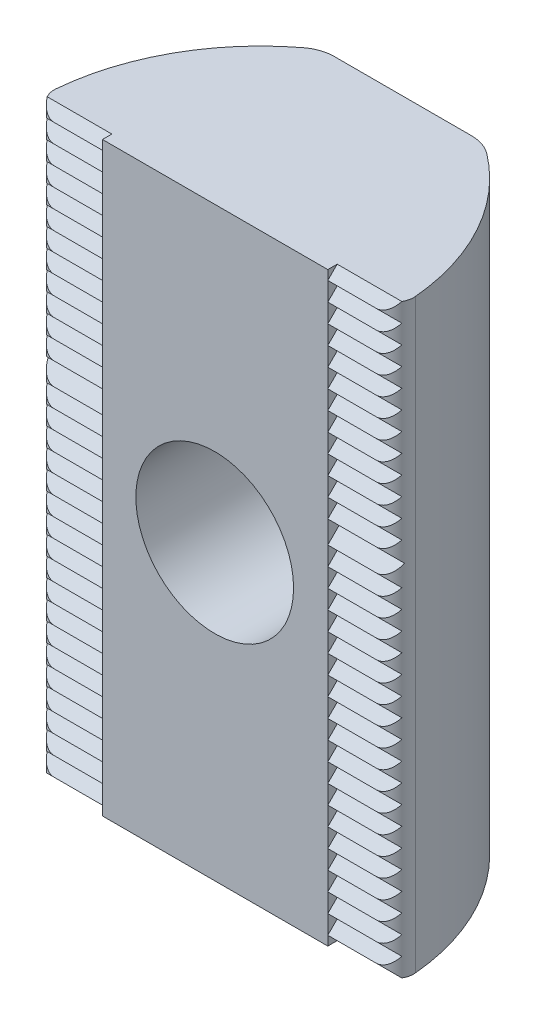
SolidWorks part; units mm, degrees
ref_plane "正面" through (0, 0, 0) normal (0, 0, 1) x (1, 0, 0)
ref_plane "平面" through (0, 0, 0) normal (0, 1, 0) x (1, 0, 0)
ref_plane "右側面" through (0, 0, 0) normal (1, 0, 0) x (0, 0, -1)
sketch "ｽｹｯﾁ1" plane through (0, 0, 0) normal (0, -1, 0) x (1, 0, 0)
  line L8 (-4.2884, 0) -> (4.2884, 0)
  line L9 (1.8306, -5) -> (-1.8306, -5)
  arc A8 (-4.7865, -0.544) -> (-2.4348, -4.7969) centre (1.1902, -0.0157) ccw
  arc A9 (-2.4348, -4.7969) -> (-1.8306, -5) centre (-1.8306, -4) ccw
  arc A10 (-4.2884, 0) -> (-4.7865, -0.544) centre (-4.2884, -0.5) ccw
  arc A11 (2.4348, -4.7969) -> (4.7865, -0.544) centre (-1.1902, -0.0157) ccw
  arc A12 (1.8306, -5) -> (2.4348, -4.7969) centre (1.8306, -4) ccw
  arc A13 (4.7865, -0.544) -> (4.2884, 0) centre (4.2884, -0.5) ccw
extrude "押し出し1" add sketch "ｽｹｯﾁ1" along normal mid plane 15.6
hole_wizard "M5x0.8 ねじ穴1" positions "ｽｹｯﾁ3" profile "ｽｹｯﾁ2" tap size "M5x0.8" standard "JIS"
sketch "ｽｹｯﾁ3" plane through (1.3374, 5.2145, 0) normal (0, 0, 1) x (1, 0, 0)
  line L1 (2.951, -13.0145) -> (-5.6258, -13.0145) construction
  line L3 (2.951, -13.0145) -> (2.951, 2.5855) construction
  point P0 (-1.349, -5.2145)
  dimension "D1" = 7.8
  dimension "D2" = 4.3
sketch "ｽｹｯﾁ2" plane through (-0.0116, 0, 0) normal (1, 0, 0) x (0, -1, 0)
  line L0 (0, 0) -> (0, 5)
  line L1 (0, 5) -> (2.1, 5)
  line L2 (2.1, 5) -> (2.1, 0)
  line L5 (2.1, 0) -> (0, 0)
  line L11 (0, -6.35) -> (0, 107.95) construction
  dimension "次ｻｰﾌｪｽまでのねじ下穴ﾄﾞﾘﾙの直径" = 4.2
  dimension "次ｻｰﾌｪｽまでのねじ下穴ﾄﾞﾘﾙの深さ" = 5
ref_plane "平面1" through (3, 0, 0) normal (1, 0, 0) x (0, 0, -1)
ref_plane "平面2" through (-3, 0, 0) normal (1, 0, 0) x (0, 0, -1)
sketch "ｽｹｯﾁ4" plane through (3, 0, 0) normal (1, 0, 0) x (0, 0, -1)
  line L0 (0.25, -7.8) -> (-2.0124, -7.8)
  line L1 (-2.0124, -7.8) -> (-2.0124, 7.8)
  line L2 (-2.0124, 7.8) -> (0.25, 7.8)
  line L3 (0, -7.05) -> (0.25, -6.8)
  line L6 (0.25, -7.3) -> (0, -7.05)
  line L7 (0.25, -7.8) -> (0, -7.55)
  line L8 (0, -7.55) -> (0.25, -7.3)
  line L9 (0, 4.55) -> (0.25, 4.8)
  line L10 (0.25, -1.3) -> (0, -1.05)
  line L13 (0.25, -4.3) -> (0, -4.05)
  line L14 (0, -6.55) -> (0.25, -6.3)
  line L15 (0.25, -6.8) -> (0, -6.55)
  line L16 (0, -4.55) -> (0.25, -4.3)
  line L17 (0.25, -5.3) -> (0, -5.05)
  line L18 (0, -6.05) -> (0.25, -5.8)
  line L19 (0.25, -6.3) -> (0, -6.05)
  line L20 (0.25, -5.8) -> (0, -5.55)
  line L21 (0, -5.55) -> (0.25, -5.3)
  line L22 (0, -5.05) -> (0.25, -4.8)
  line L23 (0.25, -4.8) -> (0, -4.55)
  line L24 (0, -2.55) -> (0.25, -2.3)
  line L25 (0.25, -3.3) -> (0, -3.05)
  line L26 (0, -4.05) -> (0.25, -3.8)
  line L27 (0.25, -3.8) -> (0, -3.55)
  line L28 (0, -3.55) -> (0.25, -3.3)
  line L29 (0, -3.05) -> (0.25, -2.8)
  line L30 (0.25, -2.8) -> (0, -2.55)
  line L31 (0, -2.05) -> (0.25, -1.8)
  line L32 (0.25, -2.3) -> (0, -2.05)
  line L33 (0.25, -1.8) -> (0, -1.55)
  line L34 (0, -1.55) -> (0.25, -1.3)
  line L37 (0, -0.55) -> (0.25, -0.3)
  line L38 (0, -1.05) -> (0.25, -0.8)
  line L39 (0.25, -0.8) -> (0, -0.55)
  line L40 (0, 1.45) -> (0.3, 1.75)
  line L41 (0.25, 0.7) -> (0, 0.95)
  line L42 (0, -0.05) -> (0.25, 0.2)
  line L43 (0.25, -0.3) -> (0, -0.05)
  line L44 (0.25, 0.2) -> (0, 0.45)
  line L45 (0, 0.45) -> (0.25, 0.7)
  line L46 (0, 0.95) -> (0.25, 1.2)
  line L47 (0.25, 1.2) -> (0, 1.45)
  line L48 (0, 3.55) -> (0.25, 3.8)
  line L49 (0.25, 2.8) -> (0, 3.05)
  line L50 (0, 2.05) -> (0.25, 2.3)
  line L51 (0.3, 1.75) -> (0, 2.05)
  line L52 (0.25, 2.3) -> (0, 2.55)
  line L53 (0, 2.55) -> (0.25, 2.8)
  line L54 (0, 3.05) -> (0.25, 3.3)
  line L55 (0.25, 3.3) -> (0, 3.55)
  line L56 (0, 4.05) -> (0.25, 4.3)
  line L57 (0.25, 3.8) -> (0, 4.05)
  line L58 (0.25, 4.3) -> (0, 4.55)
  line L60 (0.25, 7.3) -> (0, 7.55)
  line L61 (0, 5.55) -> (0.25, 5.8)
  line L62 (0.25, 4.8) -> (0, 5.05)
  line L63 (0, 5.05) -> (0.25, 5.3)
  line L64 (0.25, 5.3) -> (0, 5.55)
  line L65 (0, 7.05) -> (0.25, 7.3)
  line L66 (0.25, 6.8) -> (0, 7.05)
  line L67 (0.25, 6.3) -> (0, 6.55)
  line L68 (0, 6.55) -> (0.25, 6.8)
  line L69 (0.25, 5.8) -> (0, 6.05)
  line L70 (0, 6.05) -> (0.25, 6.3)
  line L71 (0, 7.55) -> (0.25, 7.8)
extrude "押し出し2" cut sketch "ｽｹｯﾁ4" along normal through all contours L60 L71 L2 L1 L0 L7 L8 L6 L3 L15 L14 L19 L18 L20 L21 L17 L22 L23 L16 L13 L26 L27 L28 L25 L29 L30 L24 L32 L31 L33 L34 L10 L38 L39 L37 L43 L42 L44 L45 L41 L46 L47 L40 L51 L50 L52 L53 L49 L54 L55 L48
sketch "ｽｹｯﾁ5" plane through (-3, 0, 0) normal (1, 0, 0) x (0, 0, -1)
  line L1 (-2.0124, 7.8) -> (0.25, 7.8) construction
  line L2 (-2.0124, -7.8) -> (-2.0124, 7.8) construction
  line L3 (0.25, -7.8) -> (-2.0124, -7.8) construction
  line L4 (0.25, -7.8) -> (0, -7.55) construction
  line L5 (0, -7.55) -> (0.25, -7.3) construction
  line L6 (0.25, -7.3) -> (0, -7.05) construction
  line L7 (0, -7.05) -> (0.25, -6.8) construction
  line L8 (0.25, -6.8) -> (0, -6.55) construction
  line L9 (0, -6.55) -> (0.25, -6.3) construction
  line L10 (0.25, -6.3) -> (0, -6.05) construction
  line L11 (0, -6.05) -> (0.25, -5.8) construction
  line L12 (0.25, -5.8) -> (0, -5.55) construction
  line L13 (0, -5.55) -> (0.25, -5.3) construction
  line L14 (0.25, -5.3) -> (0, -5.05) construction
  line L15 (0, -5.05) -> (0.25, -4.8) construction
  line L16 (0.25, -4.8) -> (0, -4.55) construction
  line L17 (0, -4.55) -> (0.25, -4.3) construction
  line L18 (0.25, -4.3) -> (0, -4.05) construction
  line L19 (0, -4.05) -> (0.25, -3.8) construction
  line L20 (0.25, -3.8) -> (0, -3.55) construction
  line L21 (0, -3.55) -> (0.25, -3.3) construction
  line L22 (0.25, -3.3) -> (0, -3.05) construction
  line L23 (0, -3.05) -> (0.25, -2.8) construction
  line L24 (0.25, -2.8) -> (0, -2.55) construction
  line L25 (0, -2.55) -> (0.25, -2.3) construction
  line L26 (0.25, -2.3) -> (0, -2.05) construction
  line L27 (0, -2.05) -> (0.25, -1.8) construction
  line L28 (0.25, -1.8) -> (0, -1.55) construction
  line L29 (0, -1.55) -> (0.25, -1.3) construction
  line L30 (0.25, -1.3) -> (0, -1.05) construction
  line L31 (0, -1.05) -> (0.25, -0.8) construction
  line L32 (0.25, -0.8) -> (0, -0.55) construction
  line L33 (0, -0.55) -> (0.25, -0.3) construction
  line L34 (0.25, -0.3) -> (0, -0.05) construction
  line L35 (0, -0.05) -> (0.25, 0.2) construction
  line L36 (0.25, 0.2) -> (0, 0.45) construction
  line L37 (0, 0.45) -> (0.25, 0.7) construction
  line L38 (0.25, 0.7) -> (0, 0.95) construction
  line L39 (0, 0.95) -> (0.25, 1.2) construction
  line L40 (0.25, 1.2) -> (0, 1.45) construction
  line L41 (0, 1.45) -> (0.3, 1.75) construction
  line L42 (0.3, 1.75) -> (0, 2.05) construction
  line L43 (0, 2.05) -> (0.25, 2.3) construction
  line L44 (0.25, 2.3) -> (0, 2.55) construction
  line L45 (0, 2.55) -> (0.25, 2.8) construction
  line L46 (0.25, 2.8) -> (0, 3.05) construction
  line L47 (0, 3.05) -> (0.25, 3.3) construction
  line L48 (0.25, 3.3) -> (0, 3.55) construction
  line L49 (0, 3.55) -> (0.25, 3.8) construction
  line L50 (0.25, 3.8) -> (0, 4.05) construction
  line L51 (0, 4.05) -> (0.25, 4.3) construction
  line L52 (0.25, 4.3) -> (0, 4.55) construction
  line L53 (0, 4.55) -> (0.25, 4.8) construction
  line L54 (0.25, 4.8) -> (0, 5.05) construction
  line L55 (0, 5.05) -> (0.25, 5.3) construction
  line L56 (0.25, 5.3) -> (0, 5.55) construction
  line L57 (0, 5.55) -> (0.25, 5.8) construction
  line L58 (0.25, 5.8) -> (0, 6.05) construction
  line L59 (0, 6.05) -> (0.25, 6.3) construction
  line L60 (0.25, 6.3) -> (0, 6.55) construction
  line L61 (0, 6.55) -> (0.25, 6.8) construction
  line L62 (0.25, 6.8) -> (0, 7.05) construction
  line L63 (0, 7.05) -> (0.25, 7.3) construction
  line L64 (0.25, 7.3) -> (0, 7.55) construction
  line L65 (0, 7.55) -> (0.25, 7.8) construction
  line L67 (-2.0124, 7.8) -> (0.25, 7.8)
  line L68 (-2.0124, -7.8) -> (-2.0124, 7.8)
  line L69 (0.25, -7.8) -> (-2.0124, -7.8)
  line L70 (0.25, -7.8) -> (0, -7.55)
  line L71 (0, -7.55) -> (0.25, -7.3)
  line L72 (0.25, -7.3) -> (0, -7.05)
  line L73 (0, -7.05) -> (0.25, -6.8)
  line L74 (0.25, -6.8) -> (0, -6.55)
  line L75 (0, -6.55) -> (0.25, -6.3)
  line L76 (0.25, -6.3) -> (0, -6.05)
  line L77 (0, -6.05) -> (0.25, -5.8)
  line L78 (0.25, -5.8) -> (0, -5.55)
  line L79 (0, -5.55) -> (0.25, -5.3)
  line L80 (0.25, -5.3) -> (0, -5.05)
  line L81 (0, -5.05) -> (0.25, -4.8)
  line L82 (0.25, -4.8) -> (0, -4.55)
  line L83 (0, -4.55) -> (0.25, -4.3)
  line L84 (0.25, -4.3) -> (0, -4.05)
  line L85 (0, -4.05) -> (0.25, -3.8)
  line L86 (0.25, -3.8) -> (0, -3.55)
  line L87 (0, -3.55) -> (0.25, -3.3)
  line L88 (0.25, -3.3) -> (0, -3.05)
  line L89 (0, -3.05) -> (0.25, -2.8)
  line L90 (0.25, -2.8) -> (0, -2.55)
  line L91 (0, -2.55) -> (0.25, -2.3)
  line L92 (0.25, -2.3) -> (0, -2.05)
  line L93 (0, -2.05) -> (0.25, -1.8)
  line L94 (0.25, -1.8) -> (0, -1.55)
  line L95 (0, -1.55) -> (0.25, -1.3)
  line L96 (0.25, -1.3) -> (0, -1.05)
  line L97 (0, -1.05) -> (0.25, -0.8)
  line L98 (0.25, -0.8) -> (0, -0.55)
  line L99 (0, -0.55) -> (0.25, -0.3)
  line L100 (0.25, -0.3) -> (0, -0.05)
  line L101 (0, -0.05) -> (0.25, 0.2)
  line L102 (0.25, 0.2) -> (0, 0.45)
  line L103 (0, 0.45) -> (0.25, 0.7)
  line L104 (0.25, 0.7) -> (0, 0.95)
  line L105 (0, 0.95) -> (0.25, 1.2)
  line L106 (0.25, 1.2) -> (0, 1.45)
  line L107 (0, 1.45) -> (0.3, 1.75)
  line L108 (0.3, 1.75) -> (0, 2.05)
  line L109 (0, 2.05) -> (0.25, 2.3)
  line L110 (0.25, 2.3) -> (0, 2.55)
  line L111 (0, 2.55) -> (0.25, 2.8)
  line L112 (0.25, 2.8) -> (0, 3.05)
  line L113 (0, 3.05) -> (0.25, 3.3)
  line L114 (0.25, 3.3) -> (0, 3.55)
  line L115 (0, 3.55) -> (0.25, 3.8)
  line L116 (0.25, 3.8) -> (0, 4.05)
  line L117 (0, 4.05) -> (0.25, 4.3)
  line L118 (0.25, 4.3) -> (0, 4.55)
  line L119 (0, 4.55) -> (0.25, 4.8)
  line L120 (0.25, 4.8) -> (0, 5.05)
  line L121 (0, 5.05) -> (0.25, 5.3)
  line L122 (0.25, 5.3) -> (0, 5.55)
  line L123 (0, 5.55) -> (0.25, 5.8)
  line L124 (0.25, 5.8) -> (0, 6.05)
  line L125 (0, 6.05) -> (0.25, 6.3)
  line L126 (0.25, 6.3) -> (0, 6.55)
  line L127 (0, 6.55) -> (0.25, 6.8)
  line L128 (0.25, 6.8) -> (0, 7.05)
  line L129 (0, 7.05) -> (0.25, 7.3)
  line L130 (0.25, 7.3) -> (0, 7.55)
  line L131 (0, 7.55) -> (0.25, 7.8)
extrude "押し出し3" cut sketch "ｽｹｯﾁ5" against normal through all contours L130 L131 L67 L68 L69 L70 L71 L72 L73 L74 L75 L76 L77 L78 L79 L80 L81 L82 L83 L84 L85 L86 L87 L88 L89 L90 L91 L92 L93 L94 L95 L96 L97 L98 L99 L100 L101 L102 L103 L104 L105 L106 L107 L108 L109 L110 L111 L112 L113 L114 L115
